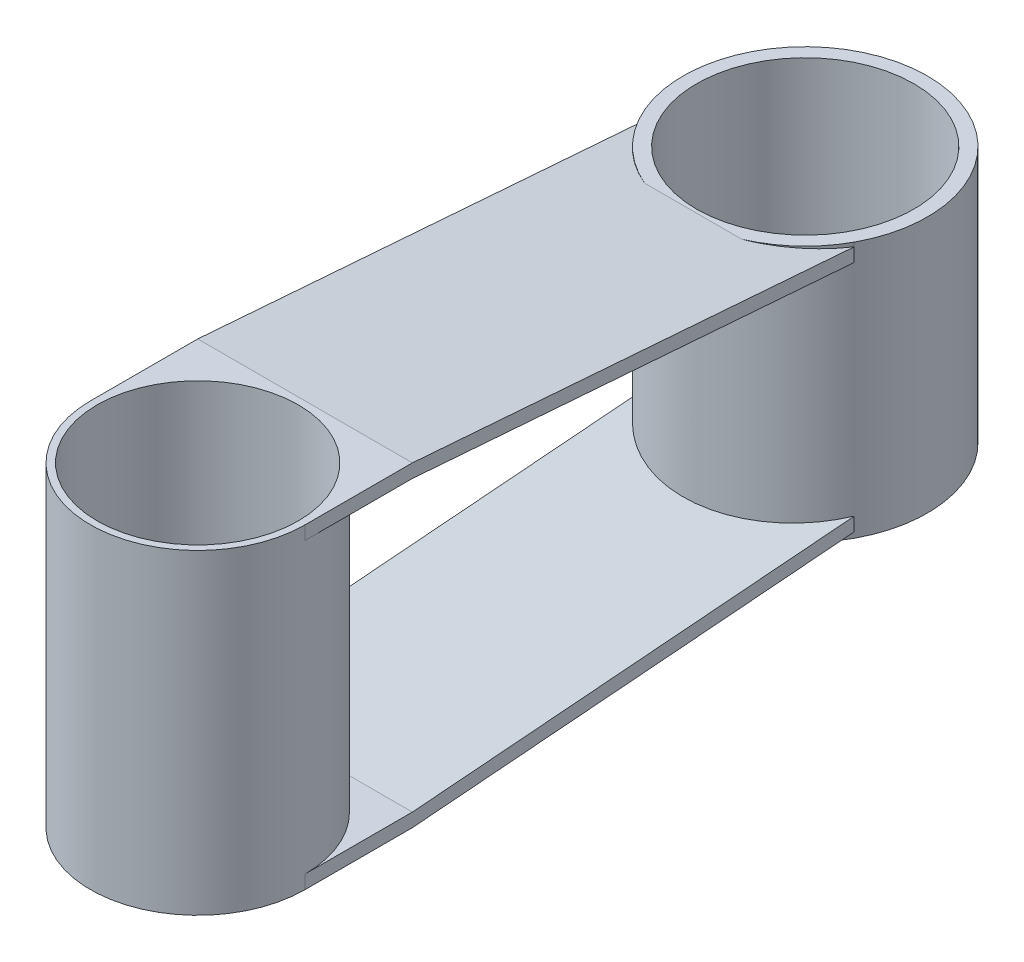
SolidWorks part; units mm, degrees
ref_plane "Front Plane" through (0, 0, 0) normal (0, 0, 1) x (1, 0, 0)
ref_plane "Top Plane" through (0, 0, 0) normal (0, 1, 0) x (1, 0, 0)
ref_plane "Right Plane" through (0, 0, 0) normal (1, 0, 0) x (0, 0, -1)
sketch "Sketch1" plane through (0, 0, 0) normal (0, 1, 0) x (1, 0, 0)
  circle A0 centre (0, 0) radius 79.5
  circle A1 centre (0, 0) radius 74.5
  dimension "D1" = 159
  dimension "D2" = 5
extrude "Boss-Extrude1" add sketch "Sketch1" along normal mid plane 234.04
sketch "Sketch2" plane through (0, 0, 0) normal (1, 0, 0) x (0, 0, -1)
  line L0 (450, 111) -> (450, 78.6092) construction
  line L1 (0, 117.02) -> (0, -117.02) construction
  line L2 (79.5, 117.02) -> (-79.5, 117.02) construction
  line L3 (-79.5, -117.02) -> (79.5, -117.02) construction
  line L4 (0, 0) -> (450, 0) construction
  line L5 (79.5, 117.02) -> (450, 88.6385)
  line L6 (79.5, -117.02) -> (450, -87.3724)
  line L7 (450, 88.6385) -> (450, 78.6092)
  line L9 (79.5, -117.02) -> (79.5, 117.02) construction
  line L10 (79.5, -117.02) -> (79.5, -106.988)
  line L11 (450, -77.3404) -> (450, -87.3724)
  line L12 (79.5, 106.9907) -> (450, 78.6092)
  line L14 (79.5, -106.988) -> (450, -77.3404)
  line L17 (79.5, 106.9907) -> (79.5, 117.02)
  dimension "D1" = 450
  dimension "D2" = 10
  dimension "D3" = 10
  dimension "D4" = 4.38
  dimension "D5" = 4.575
extrude "Boss-Extrude2" add sketch "Sketch2" along normal mid plane 159 separate body
sketch "Sketch3" plane through (0, 0, -79.5) normal (0, 0, 1) x (1, 0, 0)
  line L4 (-79.5, -106.988) -> (-79.5, -117.02)
  line L5 (-79.5, -117.02) -> (79.5, -117.02)
  line L6 (79.5, -117.02) -> (79.5, -106.988)
  line L7 (79.5, -106.988) -> (-79.5, -106.988)
  line L8 (-79.5, -106.988) -> (-79.5, -117.02)
  line L9 (-79.5, -117.02) -> (79.5, -117.02)
  line L10 (79.5, -117.02) -> (79.5, -106.988)
  line L11 (79.5, -106.988) -> (-79.5, -106.988)
  line L12 (-79.5, 117.02) -> (-79.5, 106.9907)
  line L13 (-79.5, 106.9907) -> (79.5, 106.9907)
  line L14 (79.5, 106.9907) -> (79.5, 117.02)
  line L15 (79.5, 117.02) -> (-79.5, 117.02)
  line L16 (-79.5, 117.02) -> (-79.5, 106.9907)
  line L17 (-79.5, 106.9907) -> (79.5, 106.9907)
  line L18 (79.5, 106.9907) -> (79.5, 117.02)
  line L19 (79.5, 117.02) -> (-79.5, 117.02)
  dimension "D1" = 0
  dimension "D2" = 0
extrude "Boss-Extrude3" add sketch "Sketch3" along normal up to body separate body
sketch "Sketch4" plane through (0, 0, 0) normal (0, 1, 0) x (1, 0, 0)
  line L0 (0, 0) -> (0, 369.5) construction
  circle A0 centre (0, 450) radius 80.5
  circle A1 centre (0, 450) radius 90.5
  dimension "D3" = 161
  dimension "D1" = 450
  dimension "D2" = 10
extrude "Boss-Extrude4" add sketch "Sketch4" along normal mid plane 190
sketch "Sketch5" plane through (0, 122.3918, -9.3756) normal (0, 0.9971, -0.0764) x (1, 0, 0)
  line L3 (-79.5, 441.9153) -> (-79.5, 429.2291)
  line L4 (79.5, 429.2291) -> (79.5, 441.9153)
  line L5 (79.5, 441.9153) -> (-79.5, 441.9153)
  line L6 (-79.5, 441.9153) -> (-79.5, 429.2291)
  line L7 (79.5, 429.2291) -> (79.5, 441.9153)
  line L8 (79.5, 441.9153) -> (-79.5, 441.9153)
  ellipse E1 centre (0, 441.9153) end of major axis (0, 522.6511) minor radius 80.5 (-79.5, 429.2291) -> (79.5, 429.2291) ccw
  ellipse E2 centre (0, 441.9153) end of major axis (0, 522.6511) minor radius 80.5 (-79.5, 429.2291) -> (79.5, 429.2291) ccw
  dimension "D1" = 0
other "Move Face1"
sketch "Sketch6" plane through (0, 0, 0) normal (0, 1, 0) x (1, 0, 0)
  circle A0 centre (0, 450) radius 80.5 construction
  circle A1 centre (0, 450) radius 80.5
extrude "Cut-Extrude3" cut sketch "Sketch6" against normal through all both and the other way through all
sketch "Sketch7" plane through (0, 0, 0) normal (1, 0, 0) x (0, 0, -1)
  line L0 (359.5, 0.4797) -> (721.5, 0.4797) construction
  line L1 (359.5, 85.5418) -> (359.5, -84.5823) construction
  line L2 (450, 88.6385) -> (450, -86.0064) construction
  circle A0 centre (631, 0.4797) radius 90.5
  circle A1 centre (631, 0.4797) radius 80.5
  dimension "D1" = 181
  dimension "D2" = 181
  dimension "D3" = 10
extrude "Boss-Extrude5" add sketch "Sketch7" along normal mid plane 180 separate body
sketch "Sketch8" plane through (0, 0, 0) normal (1, 0, 0) x (0, 0, -1)
  line L0 (540.5, 95) -> (631, 90.9797)
  line L1 (540.5, -95) -> (631, -90.0203)
  line L2 (540.5, -95) -> (540.5, 0.4797) construction
  line L3 (540.5, 0.4797) -> (540.5, 95) construction
  line L4 (540.5, -95) -> (540.5, 0.4797)
  line L5 (540.5, 0.4797) -> (540.5, 95)
  circle A0 centre (631, 0.4797) radius 90.5 construction
  arc A1 (631, 90.9797) -> (631, -90.0203) centre (631, 0.4797) ccw
  dimension "D1" = 90.5
  dimension "D2" = 90.5
extrude "Boss-Extrude6" add sketch "Sketch8" along normal mid plane 10 contours A1 L0 L5 | A1 L4 L1
